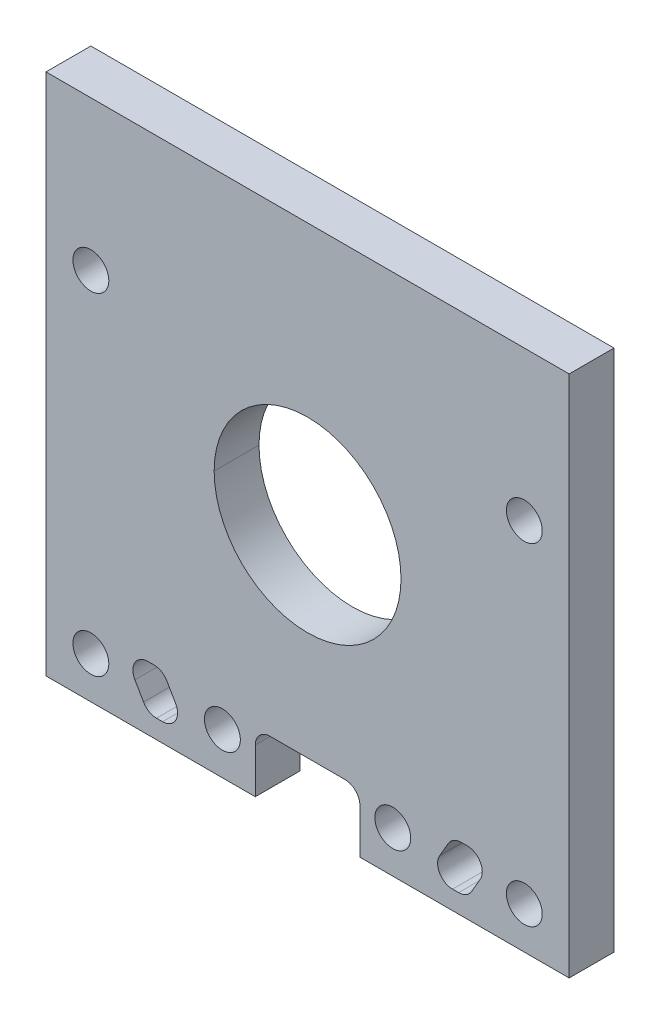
SolidWorks part; units mm, degrees
ref_plane "Спереди" through (0, 0, 0) normal (0, 0, 1) x (1, 0, 0)
ref_plane "Сверху" through (0, 0, 0) normal (0, 1, 0) x (1, 0, 0)
ref_plane "Справа" through (0, 0, 0) normal (1, 0, 0) x (0, 0, -1)
imported_body "Импортированный1"
hole_wizard "Отверстие с зазором M21" positions "Эскиз1" profile "Эскиз2" hole size "M2" standard "DIN"
sketch "Эскиз1" plane through (0, 0, 3) normal (0, 0, 1) x (1, 0, 0)
  point P0 (32, 25)
  point P3 (3, 25)
  point P6 (3, 2.8)
  point P9 (11.8, 2.8)
  point P12 (23.2, 2.8)
  point P15 (32, 2.8)
sketch "Эскиз2" plane through (32, 25, 3) normal (1, 0, 0) x (0, -1, 0)
  line L0 (0, 0) -> (0, 3)
  line L1 (0, 3) -> (1.2, 3)
  line L2 (1.2, 3) -> (1.2, 0)
  line L5 (1.2, 0) -> (0, 0)
  line L11 (0, -6.35) -> (0, 107.95) construction
  dimension "Диаметр сквозного отверстия" = 2.4
  dimension "Глубина сквозного отверстия" = 3
